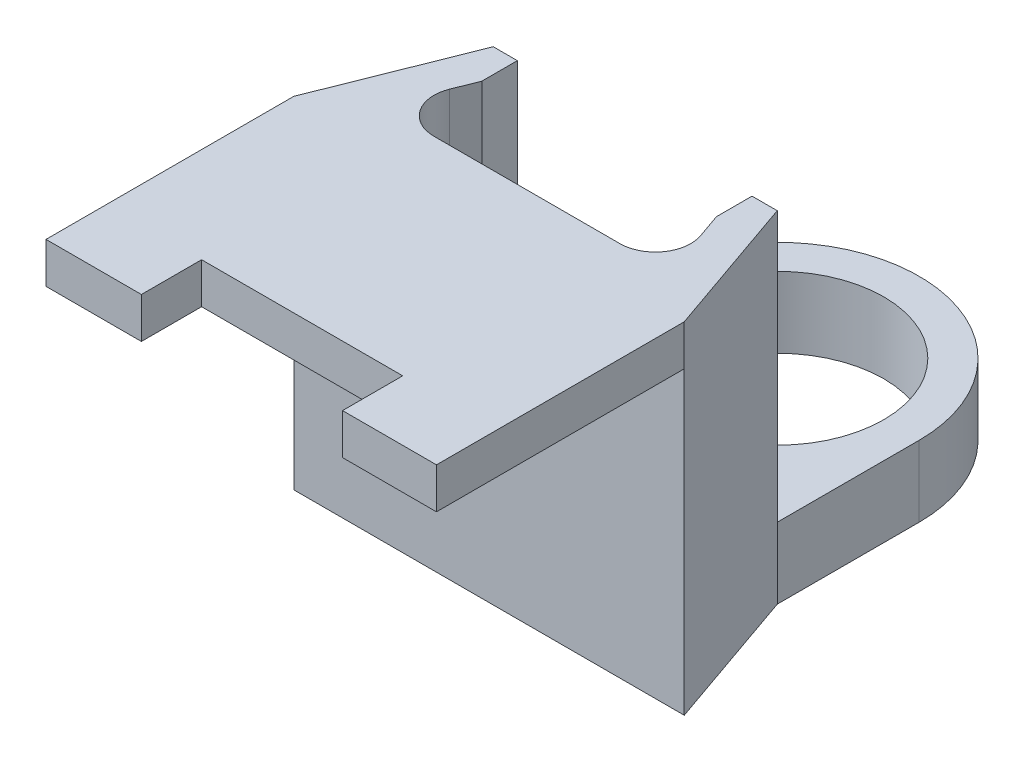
SolidWorks part; units mm, degrees
ref_plane "前视基准面" through (0, 0, 0) normal (0, 0, 1) x (1, 0, 0)
ref_plane "上视基准面" through (0, 0, 0) normal (0, 1, 0) x (1, 0, 0)
ref_plane "右视基准面" through (0, 0, 0) normal (1, 0, 0) x (0, 0, -1)
sketch "草图1" plane through (0, 0, 0) normal (0, 1, 0) x (1, 0, 0)
  line L1 (0, 20) -> (20, 20)
  line L2 (20, 20) -> (20, -20)
  line L3 (20, -20) -> (-20, -20)
  line L4 (-20, -20) -> (-20, 20)
  line L5 (-20, 20) -> (0, 20)
  circle A0 centre (0, 0) radius 15
  dimension "D1" = 20
  dimension "D2" = 20
  dimension "D3" = 20
  dimension "D4" = 20
  dimension "D5" = 30
extrude "凸台-拉伸1" add sketch "草图1" along normal blind 10
sketch "草图2" plane through (0, 10, 0) normal (0, 1, 0) x (1, 0, 0)
  line L0 (20, 0) -> (20, 20)
  line L1 (20, 20) -> (-20, 20)
  line L2 (-20, 20) -> (-20, 0)
  arc A0 (20, 0) -> (-20, 0) centre (0, 0) ccw
extrude "切除-拉伸1" cut sketch "草图2" against normal blind 10 contours A0 M4 M1 | A0 L1 M2
sketch "草图3" plane through (0, 10, 0) normal (0, 1, 0) x (1, 0, 0)
  line L0 (-28, -40.1) -> (27, -40.1)
  line L1 (27, -40.1) -> (20, -20)
  line L2 (20, -20) -> (-20, -20)
  line L3 (-20, -20) -> (-28, -40.1)
extrude "凸台-拉伸2" add sketch "草图3" against normal blind 10
sketch "草图4" plane through (0, 10, 0) normal (0, 1, 0) x (1, 0, 0)
  line L0 (-20, -20) -> (20, -20)
  line L1 (20, -20) -> (27, -40.1)
  line L2 (27, -40.1) -> (-28, -40.1)
  line L3 (-28, -40.1) -> (-20, -20)
extrude "凸台-拉伸3" add sketch "草图4" along normal blind 38
sketch "草图5" plane through (0, 48, 0) normal (0, 1, 0) x (1, 0, 0)
  line L8 (-20.6285, -35.1) -> (19.9642, -35.1)
  line L9 (19.9642, -35.1) -> (16.4468, -25)
  line L10 (16.4468, -25) -> (-16.6086, -25)
  line L11 (-16.6086, -25) -> (-20.6285, -35.1)
  line L12 (-20.6285, -35.1) -> (19.9642, -35.1)
  line L13 (19.9642, -35.1) -> (16.4468, -25)
  line L15 (-16.6086, -25) -> (-20.6285, -35.1)
  line L16 (-16.6086, -25) -> (-16.6086, -20)
  line L17 (16.4468, -25) -> (16.4468, -20)
  line L20 (-28, -40.1) -> (27, -40.1)
  line L21 (27, -40.1) -> (20, -20)
  line L22 (20, -20) -> (-20, -20)
  line L23 (-20, -20) -> (-28, -40.1)
  line L26 (16.4468, -20) -> (-16.6086, -20)
  dimension "D1" = 5
  dimension "D2" = 0
extrude "切除-拉伸2" cut sketch "草图5" against normal up to surface (38 mm away)
sketch "草图6" plane through (0, 0, 40.1) normal (0, 0, 1) x (1, 0, 0)
  line L0 (27, 0) -> (27, 48) construction
  line L1 (-28, 48) -> (27, 48)
  line L2 (-28, 48) -> (-28, 42.2641)
  line L3 (-28, 42.2641) -> (27, 42.2641)
  line L4 (27, 48) -> (27, 42.2641)
extrude "凸台-拉伸4" add sketch "草图6" along normal up to surface (34.9 mm away)
sketch "草图7" plane through (0, 48, 0) normal (0, 1, 0) x (1, 0, 0)
  line L0 (-14.5623, -75) -> (-14.5623, -59.6896)
  line L1 (-28, -75) -> (27, -75) construction
  line L2 (-14.5623, -59.6896) -> (13.7663, -59.6896)
  line L3 (13.7663, -59.6896) -> (13.7663, -75)
  line L4 (13.7663, -75) -> (-14.5623, -75)
extrude "切除-拉伸3" cut sketch "草图7" against normal up to next
sketch "草图8" plane through (0, 0, 75) normal (0, 0, -1) x (-1, 0, 0)
  line L1 (28, 48) -> (-27, 48)
  line L2 (28, 48) -> (28, 57.2)
  line L3 (28, 57.2) -> (-27, 57.2)
  line L4 (-27, 48) -> (-27, 57.2)
  circle A0 centre (14.5, 48.2206) radius 2.75
  circle A1 centre (-13.5, 48.2206) radius 2.75
sketch "草图9" plane through (0, 0, 59.6896) normal (0, 0, 1) x (1, 0, 0)
  line L8 (-14.5623, 42.2641) -> (13.7663, 42.2641)
  line L9 (13.7663, 42.2641) -> (13.7663, 48)
  line L10 (13.7663, 48) -> (-14.5623, 48)
  line L11 (-14.5623, 48) -> (-14.5623, 42.2641)
  line L12 (-14.5623, 42.2641) -> (13.7663, 42.2641)
  line L13 (13.7663, 42.2641) -> (13.7663, 48)
  line L14 (13.7663, 48) -> (-14.5623, 48)
  line L15 (-14.5623, 48) -> (-14.5623, 42.2641)
  dimension "D1" = 0
extrude "凸台-拉伸6" add sketch "草图9" along normal up to vertex
fillet "圆角1" radius 5 2 edges at (19.9642, 29, 35.1) (-20.6285, 29, 35.1)
ref_plane "基准面1" through (-0.0809, 0, 0) normal (1, 0, 0) x (0, 0, -1)
sketch "草图10" plane through (-0.0809, 0, 0) normal (1, 0, 0) x (0, 0, -1)
  line L0 (-17.0153, 10.3522) -> (-31.3082, 23.4176)
rib "筋2" sketch "草图10" sketch "草图10" thickness 10 extrusion direction parallel to sketch draft on no parameters "D1"=10
fillet "圆角2" radius 10 2 edges at (4.9191, 18.4419, 35.1) (-5.0809, 18.4419, 35.1)
